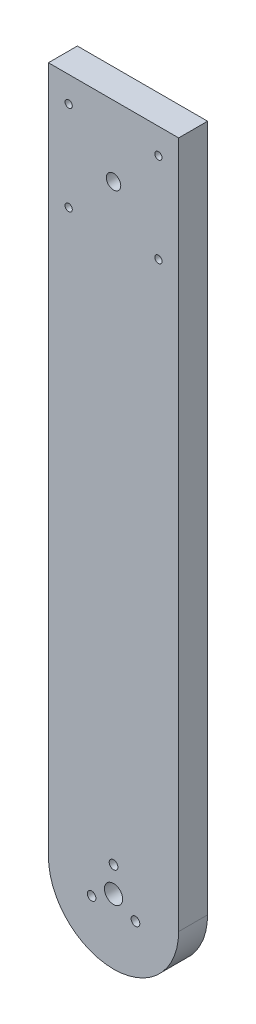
SolidWorks part; units mm, degrees
ref_plane "Front Plane" through (0, 0, 0) normal (0, 0, 1) x (1, 0, 0)
ref_plane "Top Plane" through (0, 0, 0) normal (0, 1, 0) x (1, 0, 0)
ref_plane "Right Plane" through (0, 0, 0) normal (1, 0, 0) x (0, 0, -1)
sketch "Sketch1" plane through (0, 0, 0) normal (0, 0, 1) x (1, 0, 0)
  line L0 (0, -1565.9861) -> (0, 76733.3209) construction
  line L1 (-22.5, 130) -> (22.5, 130)
  line L2 (-22.5, 130) -> (-22.5, -107.5)
  line L4 (22.5, 130) -> (22.5, -107.5)
  line L5 (-22.5, 130) -> (22.5, -130) construction
  line L6 (-22.5, -130) -> (22.5, 130) construction
  line L7 (-1565.9861, 0) -> (76733.3209, 0) construction
  line L8 (-42.7696, 105.6639) -> (42.7696, 105.6639) construction
  line L9 (-21.1, 126.7639) -> (21.1, 126.7639) construction
  line L10 (-21.1, 126.7639) -> (-21.1, 84.5639) construction
  line L11 (-21.1, 84.5639) -> (21.1, 84.5639) construction
  line L12 (21.1, 126.7639) -> (21.1, 84.5639) construction
  line L13 (-21.1, 126.7639) -> (21.1, 84.5639) construction
  line L14 (-21.1, 84.5639) -> (21.1, 126.7639) construction
  circle A0 centre (-15.5, 121.1639) radius 1.25
  circle A1 centre (15.5, 121.1639) radius 1.25
  circle A2 centre (15.5, 90.1639) radius 1.25
  circle A3 centre (-15.5, 90.1639) radius 1.25
  circle A4 centre (0, 105.6639) radius 2.5
  circle A5 centre (0, -107.5) radius 8.75 construction
  arc A6 (-22.5, -107.5) -> (22.5, -107.5) centre (0, -107.5) ccw
  circle A7 centre (0, -98.75) radius 1.5
  circle A8 centre (7.5777, -111.875) radius 1.5
  circle A9 centre (-7.5777, -111.875) radius 1.5
  circle A10 centre (0, -107.5) radius 3.15
  point P0 (0, 0)
  point P9 (0, 105.6639)
  point P20 (0, 105.6639)
  point P28 (0, 83.0234)
  point P46 (0, -107.5)
  dimension "D4" = 2.5
  dimension "D6" = 5
  dimension "D9" = 17.5
  dimension "D10" = 3
  dimension "D12" = 6.3
  dimension "D1" = 45
  dimension "D2" = 260
  dimension "D3" = 42.2
  dimension "D5" = 31
  dimension "D11" = 3
extrude "Boss-Extrude1" add sketch "Sketch1" along normal blind 10
